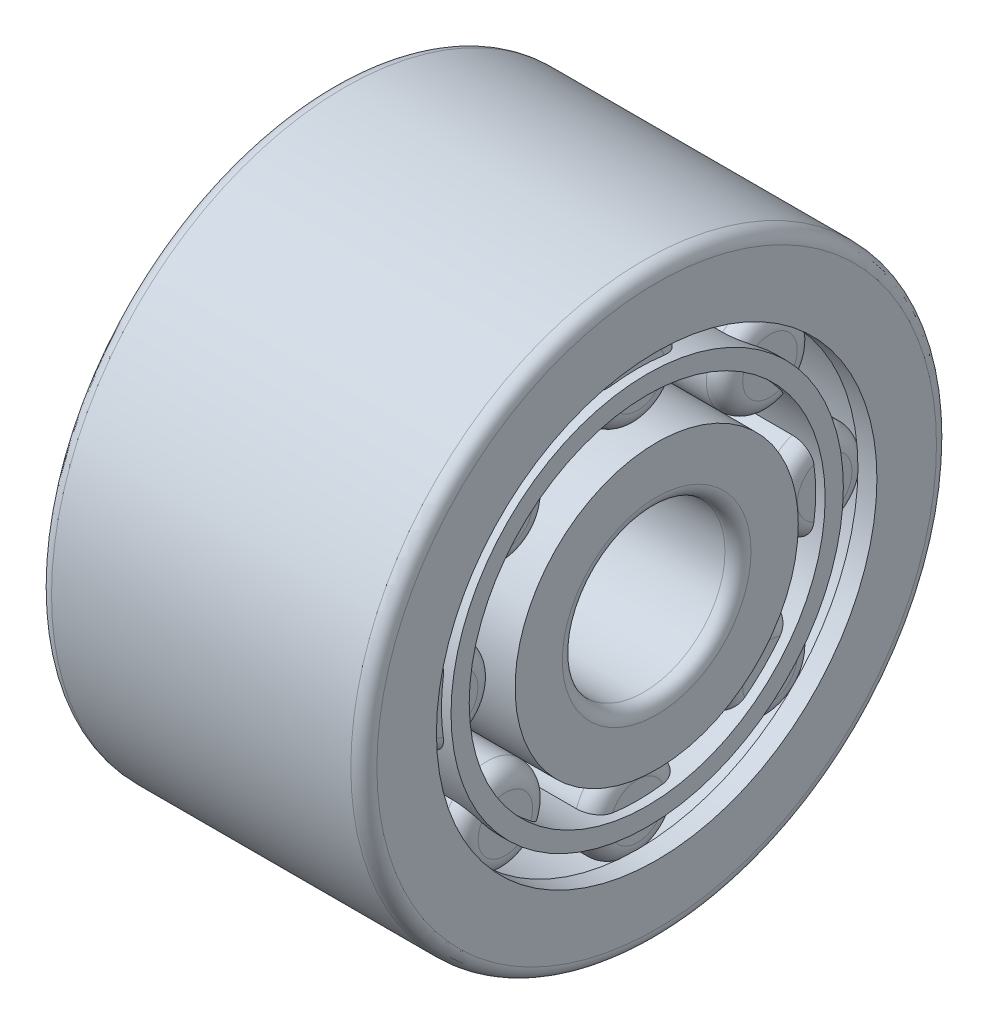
SolidWorks part; units mm, degrees
ref_plane "Plane1" through (0, 0, 0) normal (0, 0, 1) x (1, 0, 0)
ref_plane "Plane2" through (0, 0, 0) normal (0, 1, 0) x (1, 0, 0)
ref_plane "Plane3" through (0, 0, 0) normal (1, 0, 0) x (0, 0, -1)
sketch "Clipboard" plane through (0, 0, 0) normal (0, 0, 1) x (1, 0, 0)
  line L0 (-10, 0) -> (10, 0) construction
  line L1 (0, 0) -> (27.3694, -3.8465)
  line L2 (0, 0) -> (36.1572, 5.0816)
  line L3 (0, 0) -> (44.9449, -6.3166)
  line L4 (0, 0) -> (-22.3471, -0.7804)
  dimension "CLdia" = 36.5125
  dimension "Count" = 8
  dimension "Show_count" = 8
  dimension "Max_count" = 8
  dimension "Min_count" = 2
  dimension "Race_OD" = 45.3866
  dimension "Race_ID" = 27.6384
sketch "OutRacSke" plane through (0, 0, 0) normal (0, 0, 1) x (1, 0, 0)
  line L0 (-14.0229, 22.6933) -> (-14.0229, 21.4933)
  line L1 (-14.0229, 21.4933) -> (-15.875, 21.4933)
  line L2 (-15.875, 21.4933) -> (-15.875, 27.305)
  line L3 (-14.605, 28.575) -> (14.605, 28.575)
  line L4 (15.875, 27.305) -> (15.875, 21.4933)
  line L5 (15.875, 21.4933) -> (14.0229, 21.4933)
  line L6 (14.0229, 21.4933) -> (14.0229, 22.6933)
  line L7 (14.0229, 22.6933) -> (-14.0229, 22.6933)
  line L8 (-7.9375, 0) -> (7.9375, 0) construction
  arc A0 (-15.875, 27.305) -> (-14.605, 28.575) centre (-14.605, 27.305) cw
  arc A1 (14.605, 28.575) -> (15.875, 27.305) centre (14.605, 27.305) cw
  dimension "Radius" = 1.27
  dimension "D1" = 14.0229
  dimension "Race_OD" = 45.3866
  dimension "OD" = 57.15
  dimension "Cyl_Len" = 28.0458
  dimension "Width" = 31.75
  dimension "Groove_Dp" = 1.2
  dimension "halfWidth" = 15.875
revolve "OuterRace" add sketch "OutRacSke" angle 360 about L8
sketch "RolDetSke" plane through (0, 0, 0) normal (0, 0, 1) x (1, 0, 0)
  line L0 (-14.0229, 20.9188) -> (-14.0229, 18.2562)
  line L1 (-14.0229, 18.2562) -> (14.0229, 18.2562)
  line L2 (14.0229, 18.2562) -> (14.0229, 20.9188)
  line L3 (12.2479, 22.6938) -> (-12.2479, 22.6938)
  line L4 (-28.575, 18.2562) -> (28.575, 18.2562) construction
  arc A0 (14.0229, 20.9188) -> (12.2479, 22.6938) centre (12.2479, 20.9188) ccw
  arc A1 (-12.2479, 22.6938) -> (-14.0229, 20.9188) centre (-12.2479, 20.9188) ccw
  dimension "radius" = 1.775
  dimension "CLRad" = 18.2562
  dimension "Roller_diameter" = 8.8751
  dimension "Cyl_Len" = 28.0458
  dimension "halfCylLen" = 14.0229
revolve "RollerDetailed" add sketch "RolDetSke" angle 360 about L4
ref_axis "Axis1" through (-50, 0, 0) along (1, 0, 0)
sketch "RolSimSke" plane through (0, 25.4, 0) normal (0, 0, 1) x (1, 0, 0)
  line L0 (-14.0229, -4.4807) -> (-14.0229, -9.8058)
  line L1 (-25.4, -25.4) -> (25.4, -25.4) construction
  line L2 (14.0229, -9.8058) -> (14.0229, -4.4807)
  line L3 (12.2479, -2.7057) -> (-12.2479, -2.7057)
  line L5 (12.2479, -11.5808) -> (-12.2479, -11.5808)
  arc A0 (14.0229, -4.4807) -> (12.2479, -2.7057) centre (12.2479, -4.4807) ccw
  arc A1 (-12.2479, -2.7057) -> (-14.0229, -4.4807) centre (-12.2479, -4.4807) ccw
  arc A2 (14.0229, -9.8058) -> (12.2479, -11.5808) centre (12.2479, -9.8058) cw
  arc A3 (-12.2479, -11.5808) -> (-14.0229, -9.8058) centre (-12.2479, -9.8058) cw
  dimension "radius" = 1.775
  dimension "Bore" = 27.6384
  dimension "Roller_diameter" = 8.8751
  dimension "Cyl_Len" = 28.0458
  dimension "halfLength" = 14.0229
revolve "RollersSimplified" [suppressed] add sketch "RolSimSke" angle 360 about L1
sketch "InsRacSke" plane through (0, 0, 0) normal (0, 0, 1) x (1, 0, 0)
  line L2 (-15.875, 13.8192) -> (-15.875, 9.2075)
  line L4 (-14.605, 7.9375) -> (14.605, 7.9375)
  line L5 (15.875, 9.2075) -> (15.875, 13.8192)
  line L8 (15.875, 13.8192) -> (-15.875, 13.8192)
  line L9 (-7.9375, 0) -> (7.9375, 0) construction
  arc A0 (-15.875, 9.2075) -> (-14.605, 7.9375) centre (-14.605, 9.2075) ccw
  arc A2 (14.605, 7.9375) -> (15.875, 9.2075) centre (14.605, 9.2075) ccw
  dimension "radius" = 1.27
  dimension "Bore" = 15.875
  dimension "Width_IR" = 31.75
  dimension "halfWidth" = 15.875
  dimension "Race_ID" = 27.6384
revolve "InnerRace" add sketch "InsRacSke" angle 360 about L9
sketch "CagSpiSke" plane through (0, 0, 0) normal (0, 0, 1) x (1, 0, 0)
  line L0 (-17.1595, 0) -> (17.1595, 0) construction
  line L3 (-14.949, 17.3687) -> (14.949, 17.3687)
  line L4 (-14.949, 17.3687) -> (-14.949, 19.1438)
  line L5 (-14.949, 19.1438) -> (14.949, 19.1438)
  line L6 (14.949, 17.3687) -> (14.949, 19.1438)
  dimension "d2" = 34.7375
  dimension "cage_width" = 29.8979
  dimension "halfwidth" = 14.949
  dimension "cage_thickness" = 1.775
revolve "CageSpine" add sketch "CagSpiSke" angle 360 about L0
pattern_circular "RollersDetailed" count 8 every 45 about axis through (-50, 0, 0) along (1, 0, 0) of "RollerDetailed"
equation "\"halfWidth@OutRacSke\" =  \"Width@OutRacSke\" / 2"
equation "\"CLdia@Clipboard\" =  ( \"Race_OD@Clipboard\" + \"Race_ID@Clipboard\" )  / 2"
equation "\"CLRad@RolDetSke\" = ( \"Race_OD@Clipboard\" + \"Race_ID@Clipboard\" )  / 4"
equation "\"Roller_diameter@RolDetSke\" =  ( \"Race_OD@Clipboard\" -  \"Race_ID@Clipboard\" )  / 2 + .001"
equation "\"Roller_diameter@RolSimSke\" = ( \"Race_OD@Clipboard\" -  \"Race_ID@Clipboard\" )  / 2 + .001"
equation "\"radius@RolDetSke\" = \"Roller_diameter@RolDetSke\" / 5"
equation "\"radius@RolSimSke\" = \"Roller_diameter@RolSimSke\" / 5"
equation "\"Cyl_Len@OutRacSke\" = \"Cyl_Len@RolDetSke\""
equation "\"Cyl_Len@RolSimSke\" = \"Cyl_Len@RolDetSke\""
equation "\"halfCylLen@RolDetSke\" = \"Cyl_Len@RolDetSke\" / 2"
equation "\"D1@OutRacSke\" = \"Cyl_Len@OutRacSke\" / 2"
equation "\"Cage_width@CagSpiSke\" =  ( \"Cyl_Len@RolDetSke\" + \"Width@OutRacSke\" )  / 2"
equation "\"halfWidth@CagSpiSke\" = \"Cage_width@CagSpiSke\" / 2"
equation "\"Cage_thickness@CagSpiSke\"  = \"Roller_diameter@RolDetSke\" / 5"
equation "\"D2@CagSpiSke\" =  \"CLRad@RolDetSke\" * 2 - \"Cage_thickness@CagSpiSke\""
equation "\"Max_count@Clipboard\" = int( 3.14159265 / atn(( \"Roller_diameter@RolDetSke\" / 2) / sqr( \"CLRad@RolDetSke\"  *  \"CLRad@RolDetSke\" - ( \"Roller_diameter@RolDetSke\" / 2) *  ( \"Roller_diameter@RolDetSke\" / "
equation "\"Max_count@Clipboard\" = ((sgn( \"Max_count@Clipboard\" - \"Count@Clipboard\" )-1)*( \"Max_count@Clipboard\" - \"Count@Clipboard\" ))/-2+ \"Count@Clipboard\""
equation "\"Count@RollersDetailed\" = int( \"Show_count@Clipboard\" ) "
equation "\"Count@RollersDetailed\" = ((sgn( \"Count@RollersDetailed\" - \"Max_count@Clipboard\" )-1)*( \"Count@RollersDetailed\" - \"Max_count@Clipboard\" ))/-2+ \"Max_count@Clipboard\""
equation "\"Count@RollersDetailed\" = ((sgn( \"Count@RollersDetailed\" - \"Min_count@Clipboard\" )+1)*( \"Count@RollersDetailed\" - \"Min_count@Clipboard\"))/2 +\"Min_count@Clipboard\""
equation "\"Angle@RollersDetailed\" = 360.0 / \"Max_count@Clipboard\""
equation "\"Bore@RolSimSke\" = \"Race_ID@Clipboard\""
equation "\"Race_ID@InsRacSke\" = \"Race_ID@Clipboard\""
equation "\"halfWidth@InsRacSke\" = \"Width_IR@InsRacSke\" / 2"
equation "\"halfLength@RolSimSke\" = \"Cyl_Len@RolSimSke\" / 2"
equation "\"Race_OD@OutRacSke\" = \"Race_OD@Clipboard\""
equation "\"Width_IR@InsRacSke\" = \"Width@OutRacSke\""
equation "\"Angle@CageSpine\" =  \"Angle@RollersDetailed\" * ( \"Count@RollersDetailed\" -1 + int( \"Count@RollersDetailed\" / \"Max_count@Clipboard\" ) )  + 0.001 -  int( \"Count@RollersDetailed\" / \"Max_count@Clipboard\" "
equation "\"Angle@CageSpine\" =  \"Angle@CageSpine\" * int( \"Min_count@Clipboard\" / 2) + int(1 / \"Min_count@Clipboard\")  * 0.001"
equation "\"radius@InsRacSke\" = \"Radius@OutRacSke\""
